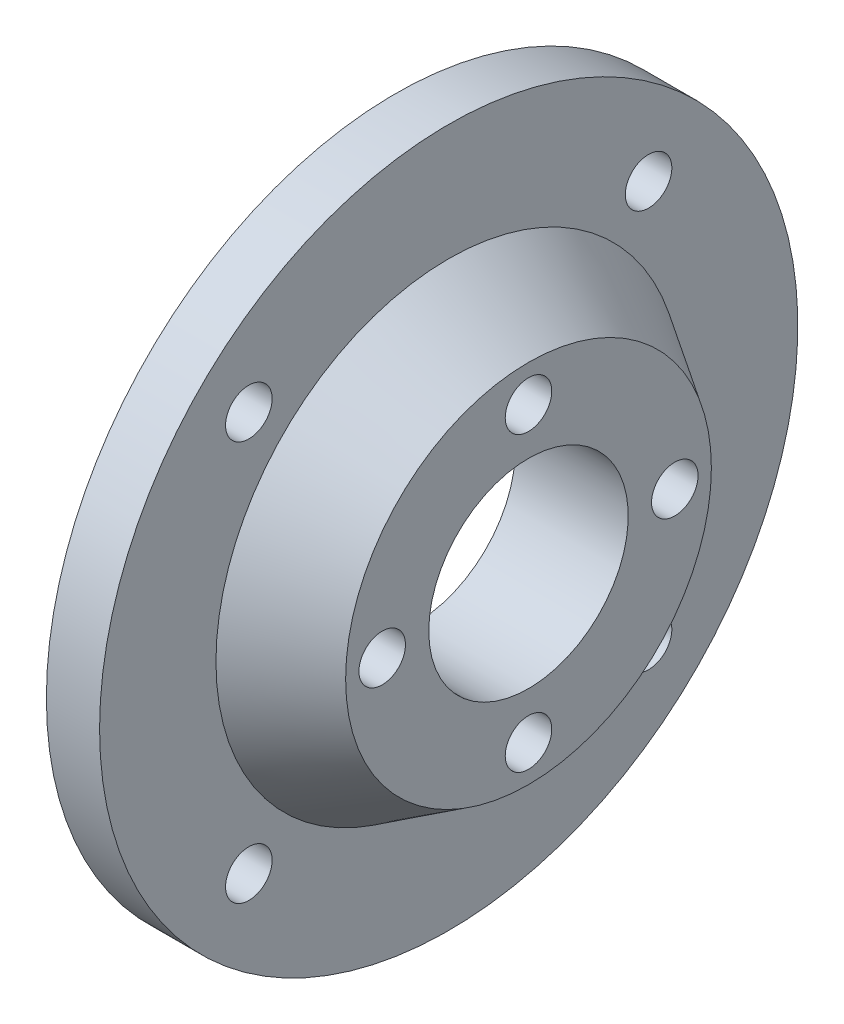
SolidWorks part; units mm, degrees
ref_plane "Face" through (0, 0, 0) normal (0, 0, 1) x (1, 0, 0)
ref_plane "Dessus" through (0, 0, 0) normal (0, 1, 0) x (1, 0, 0)
ref_plane "Droite" through (0, 0, 0) normal (1, 0, 0) x (0, 0, -1)
sketch "Esquisse1" plane through (0, 0, 0) normal (0, 0, 1) x (1, 0, 0)
  line L0 (0, 0) -> (106.1047, 0) construction
  line L1 (-17, 15) -> (-17, 35)
  line L2 (-17, 35) -> (-20, 35)
  line L3 (-20, 35) -> (-20, 52.5)
  line L4 (-20, 52.5) -> (0, 52.5)
  line L5 (0, 52.5) -> (0, 15)
  line L6 (-17, 15) -> (0, 15)
  dimension "D1" = 30
  dimension "D2" = 3
  dimension "D3" = 70
  dimension "D4" = 20
  dimension "D5" = 105
revolve "Révolution1" add sketch "Esquisse1" angle 360 about L0
sketch "Esquisse2" plane through (0, 0, 0) normal (-1, 0, 0) x (0, 0, 1)
  line L0 (0, 0) -> (0, 49.5014) construction
  line L1 (0, 0) -> (-34.4824, 34.4824) construction
  circle A0 centre (0, 0) radius 42.5 construction
  circle A1 centre (-30.052, 30.052) radius 3.5
  circle A2 centre (30.052, 30.052) radius 3.5
  circle A3 centre (30.052, -30.052) radius 3.5
  circle A4 centre (-30.052, -30.052) radius 3.5
  dimension "D1" = 7
  dimension "D3" = 85
  dimension "D2" = 45
extrude "Enlèv. mat.-Extru.1" cut sketch "Esquisse2" along normal through all
sketch "Esquisse3" plane through (0, 0, 0) normal (0, 0, 1) x (1, 0, 0)
  line L0 (-12, 56.8643) -> (-12, 35)
  line L1 (-12, 35) -> (6.2094, 23.6191)
  line L2 (6.2094, 23.6191) -> (6.2094, 56.8643)
  line L3 (6.2094, 56.8643) -> (-12, 56.8643)
  line L4 (-20, 52.5) -> (-20, -52.5) construction
  line L5 (0, 0) -> (-37.9552, 0) construction
  line L6 (0, -52.5) -> (0, 52.5) construction
  point P9 (0, 27.5)
  dimension "D1" = 8
  dimension "D2" = 35
  dimension "D3" = 27.5
revolve "Enlèvement de matière-Révolution1" cut sketch "Esquisse3" angle 360 about L5
sketch "Esquisse4" plane through (-17, 0, 0) normal (-1, 0, 0) x (0, 0, 1)
  line L0 (0, -22) -> (0, 22) construction
  line L1 (-22, 0) -> (22, 0) construction
  circle A0 centre (0, 22) radius 5
  circle A1 centre (22, 0) radius 5
  circle A2 centre (0, -22) radius 5
  circle A3 centre (-22, 0) radius 5
  dimension "D5" = 10
  dimension "D6" = 10
  dimension "D7" = 10
  dimension "D8" = 10
  dimension "D1" = 22
  dimension "D2" = 22
  dimension "D3" = 44
  dimension "D4" = 22
extrude "Enlèv. mat.-Extru.2" cut sketch "Esquisse4" against normal blind 8
sketch "Esquisse5" plane through (-17, 0, 0) normal (-1, 0, 0) x (0, 0, 1)
  circle A0 centre (0, 22) radius 3.5
  circle A1 centre (22, 0) radius 3.5
  circle A2 centre (0, -22) radius 3.5
  circle A3 centre (-22, 0) radius 3.5
  dimension "D1" = 7
  dimension "D2" = 7
  dimension "D3" = 7
  dimension "D4" = 7
extrude "Enlèv. mat.-Extru.3" cut sketch "Esquisse5" against normal blind 38
